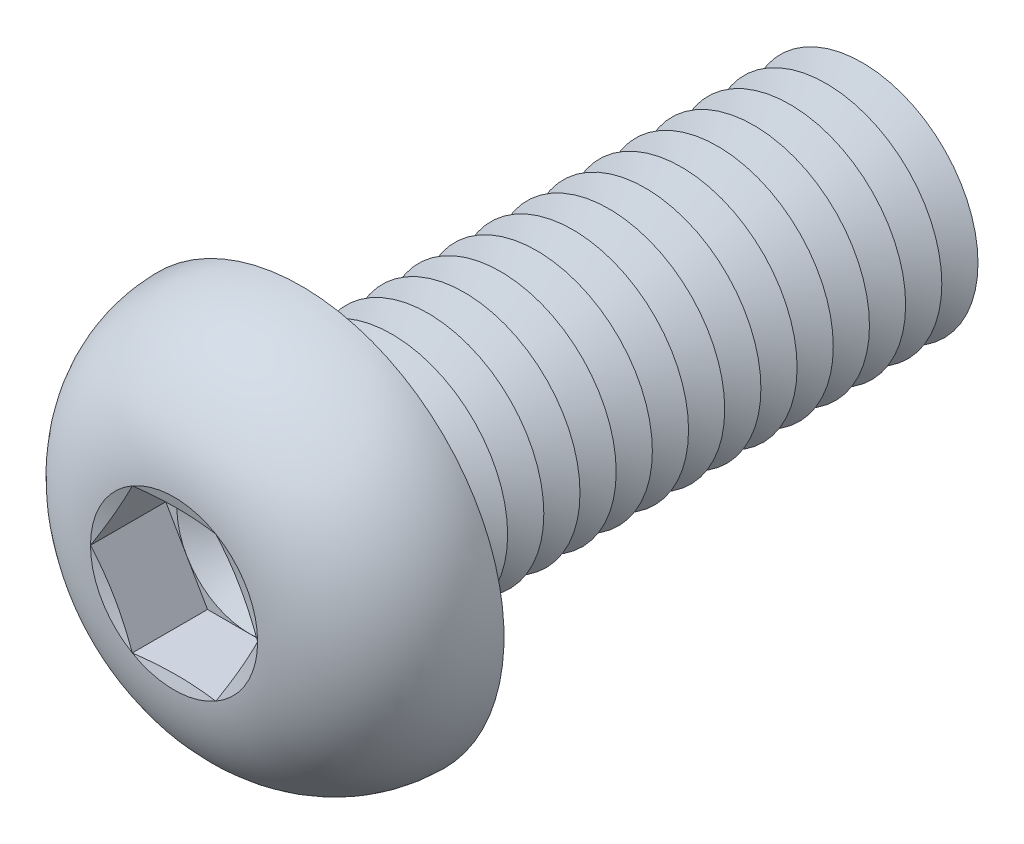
SolidWorks part; units mm, degrees
ref_plane "Front Plane" through (0, 0, 0) normal (0, 0, 1) x (1, 0, 0)
ref_plane "Top Plane" through (0, 0, 0) normal (0, 1, 0) x (1, 0, 0)
ref_plane "Right Plane" through (0, 0, 0) normal (1, 0, 0) x (0, 0, -1)
sketch "Sketch1" plane through (0, 0, 0) normal (1, 0, 0) x (0, 0, -1)
  line L0 (0, 4) -> (0, 7)
  line L3 (0, 4) -> (20, 4)
  line L4 (20, 4) -> (20, 0)
  line L5 (20, 0) -> (-4.4, 0) construction
  line L6 (-4.4, 0) -> (20, 0)
  line L7 (-4.4, 2.8867) -> (-4.4, 1.4434) construction
  line L8 (-4.4, 1.4434) -> (-4.4, 0)
  line L9 (-4.4, 2.8867) -> (-4.0132, 1.4434)
  line L10 (-4.0132, 1.4434) -> (-4.4, 1.4434)
  line L11 (20, 0) -> (22.7481, 0) construction
  line L12 (0, 7) -> (-4.4, 7) construction
  arc A1 (0, 7) -> (-4.4, 2.8867) centre (0, 2.59) ccw
  point P8 (20, 2)
  dimension "D1" = 14
  dimension "D2" = 8
  dimension "D3" = 4.4
  dimension "D4" = 5.7735
  dimension "D5" = 20
  dimension "D6" = 15
revolve "Revolve1" add sketch "Sketch1" angle 360 about L5
fillet "Fillet1" radius 0.625 1 edges at (-4, 0, 0)
sketch "Sketch2" plane through (0, 0, 0) normal (1, 0, 0) x (0, 0, -1)
  line L0 (19.375, 4) -> (20.625, 4)
  line L1 (20, 4) -> (0.625, 4) construction
  line L2 (20.625, 4) -> (20, 2.9175)
  line L3 (20, -4) -> (20, 4) construction
  line L4 (20, 2.9175) -> (19.375, 4)
  dimension "D1" = 1.25
revolve "Cut-Revolve1" cut sketch "Sketch2" angle 360 about axis through (0, 0, -20) along (0, 0, -1)
pattern_linear "LPattern1" count 16 spacing 1.25 along (0, 0, 1) of "Cut-Revolve1"
sketch "Sketch3" plane through (0, 0, 4.4) normal (0, 0, 1) x (1, 0, 0)
  line L7 (1.4434, 2.5) -> (-1.4434, 2.5)
  line L8 (-1.4434, 2.5) -> (-2.8867, 0)
  line L9 (-2.8867, 0) -> (-1.4434, -2.5)
  line L10 (-1.4434, -2.5) -> (1.4434, -2.5)
  line L11 (1.4434, -2.5) -> (2.8867, 0)
  line L12 (2.8867, 0) -> (1.4434, 2.5)
  circle A0 centre (0, 0) radius 2.5 construction
  circle A3 centre (0, 0) radius 2.8867 construction
extrude "Cut-Extrude1" cut sketch "Sketch3" against normal blind 2.6
sketch "Sketch4" plane through (0, 0, 1.8) normal (0, 0, 1) x (1, 0, 0)
  line L1 (1.4434, 2.5) -> (-1.4434, 2.5) construction
  circle A0 centre (0, 0) radius 2.5
extrude "Cut-Extrude2" cut sketch "Sketch4" against normal through all draft 60
